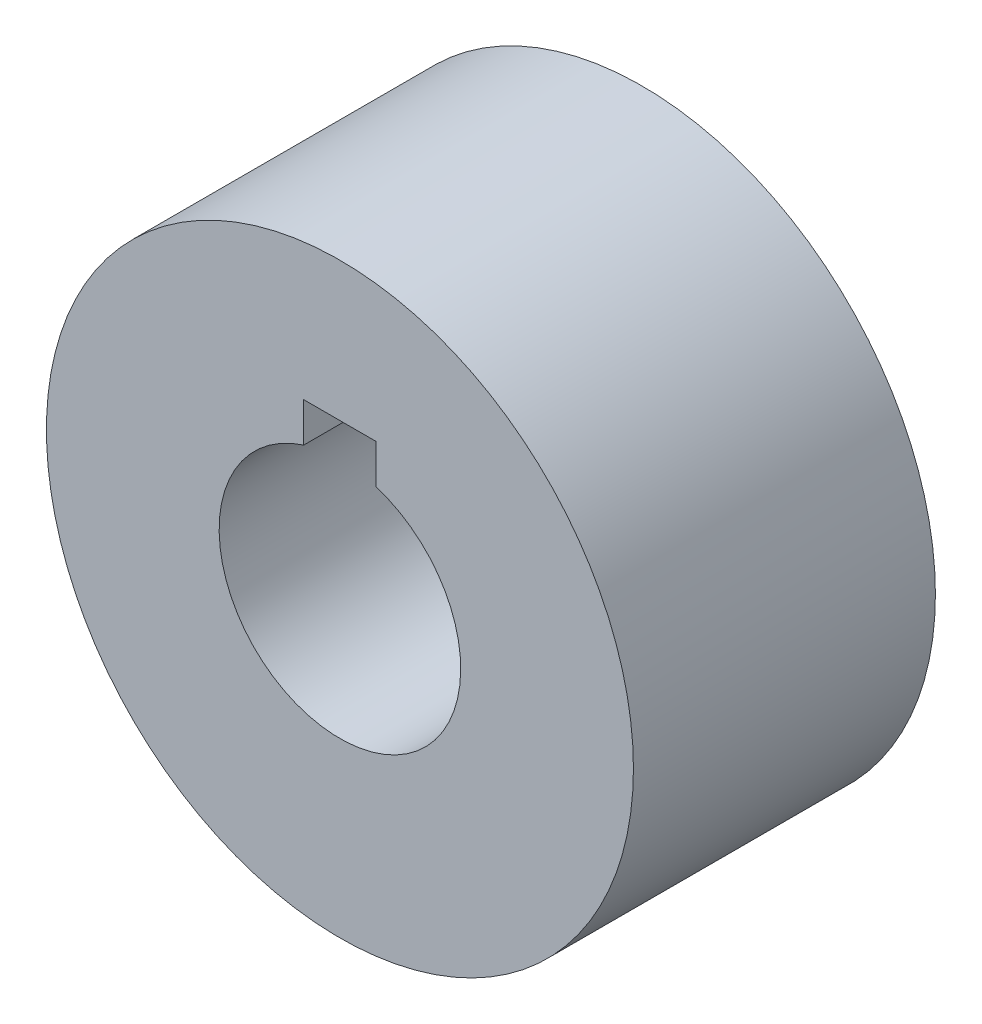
SolidWorks part; units mm, degrees
ref_plane "Front" through (0, 0, 0) normal (0, 0, 1) x (1, 0, 0)
ref_plane "Top" through (0, 0, 0) normal (0, 1, 0) x (1, 0, 0)
ref_plane "Right" through (0, 0, 0) normal (1, 0, 0) x (0, 0, -1)
sketch "Skizze1" plane through (0, 0, 0) normal (0, 0, 1) x (1, 0, 0)
  circle A0 centre (0, 0) radius 24.3
  dimension "D1" = 48.6
extrude "Linear austragen1" add sketch "Skizze1" along normal mid plane 25
sketch "Skizze3" plane through (-4.1871, -6.7972, 12.5) normal (0, 0, 1) x (1, 0, 0)
  line L0 (4.1871, 19.5972) -> (4.1871, 6.7972) construction
  line L1 (1.1871, 16.3366) -> (1.1871, 19.5972)
  line L2 (1.1871, 19.5972) -> (7.1871, 19.5972)
  line L3 (7.1871, 16.3366) -> (7.1871, 19.5972)
  arc A0 (1.1871, 16.3366) -> (7.1871, 16.3366) centre (4.1871, 6.7972) ccw
  dimension "D1" = 20
  dimension "D3" = 2.8
  dimension "D2" = 6
extrude "Bohrung mit Nut" cut sketch "Skizze3" against normal through all
other "Bohrung mit Nut-<1>"
